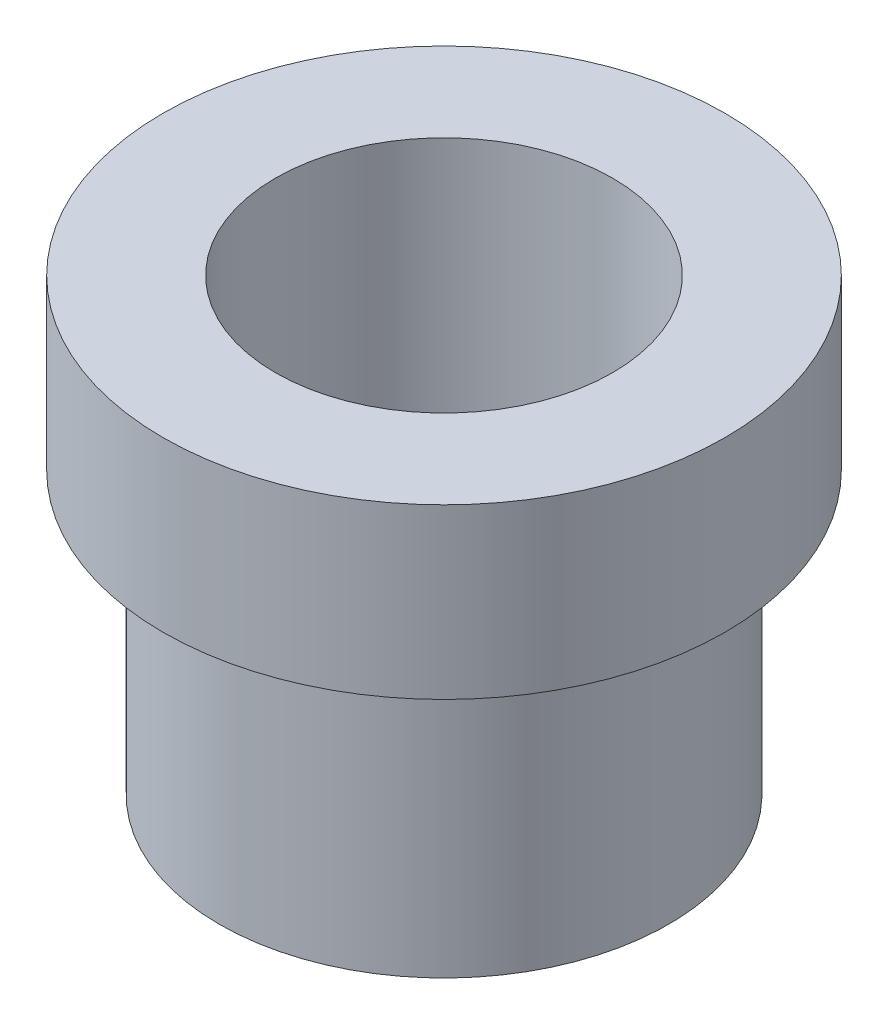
SolidWorks part; units mm, degrees
ref_plane "Front Plane" through (0, 0, 0) normal (0, 0, 1) x (1, 0, 0)
ref_plane "Top Plane" through (0, 0, 0) normal (0, 1, 0) x (1, 0, 0)
ref_plane "Right Plane" through (0, 0, 0) normal (1, 0, 0) x (0, 0, -1)
sketch "Sketch1" plane through (0, 0, 0) normal (0, 1, 0) x (1, 0, 0)
  circle A0 centre (0, 0) radius 4
  dimension "D1" = 8
extrude "Boss-Extrude1" add sketch "Sketch1" along normal blind 5
sketch "Sketch2" plane through (0, 5, 0) normal (0, 1, 0) x (1, 0, 0)
  circle A0 centre (0, 0) radius 5
  dimension "D1" = 10
extrude "Boss-Extrude2" add sketch "Sketch2" along normal blind 3
sketch "Sketch3" plane through (0, 8, 0) normal (0, 1, 0) x (1, 0, 0)
  circle A0 centre (0, 0) radius 3
  dimension "D1" = 6
extrude "Cut-Extrude1" cut sketch "Sketch3" against normal through all
